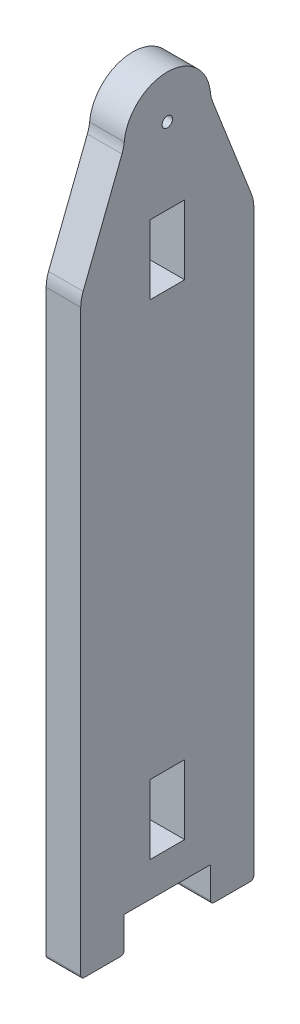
SolidWorks part; units mm, degrees
ref_plane "Front Plane" through (0, 0, 0) normal (0, 0, 1) x (1, 0, 0)
ref_plane "Top Plane" through (0, 0, 0) normal (0, 1, 0) x (1, 0, 0)
ref_plane "Right Plane" through (0, 0, 0) normal (1, 0, 0) x (0, 0, -1)
sketch "Sketch2" plane through (0, 0, 0) normal (1, 0, 0) x (0, 0, -1)
  line L0 (0, 0) -> (0, 40) construction
  line L1 (0, 40) -> (0, 320) construction
  line L2 (0, 320) -> (0, 384) construction
  line L3 (0, 0) -> (25, 0)
  line L4 (25, 0) -> (25, -20)
  line L5 (25, -20) -> (50, -20)
  line L6 (50, -20) -> (50, 320)
  line L7 (50, 320) -> (25, 384)
  line L8 (0, 0) -> (-25, 0)
  line L9 (-25, 0) -> (-25, -20)
  line L10 (-25, -20) -> (-50, -20)
  line L11 (-50, -20) -> (-50, 320)
  line L12 (-50, 320) -> (-25, 384)
  line L13 (-10, 60) -> (10, 60)
  line L14 (-10, 340) -> (10, 340)
  line L15 (-10, 340) -> (-10, 300)
  line L16 (-10, 300) -> (10, 300)
  line L17 (10, 340) -> (10, 300)
  line L18 (-10, 340) -> (10, 300) construction
  line L19 (-10, 300) -> (10, 340) construction
  line L20 (-10, 60) -> (-10, 20)
  line L21 (-10, 20) -> (10, 20)
  line L22 (10, 60) -> (10, 20)
  line L23 (-10, 60) -> (10, 20) construction
  line L24 (-10, 20) -> (10, 60) construction
  circle A0 centre (0, 384) radius 3
  arc A1 (25, 384) -> (-25, 384) centre (0, 384) ccw
  point P10 (0, 320)
  point P21 (0, 40)
  dimension "D1" = 25
  dimension "D11" = 6
  dimension "D12" = 25
  dimension "D2" = 25
  dimension "D3" = 20
  dimension "D4" = 40
  dimension "D5" = 20
  dimension "D6" = 40
  dimension "D7" = 340
  dimension "D8" = 280
  dimension "D9" = 40
  dimension "D10" = 20
  dimension "D13" = 68.7095
extrude "Boss-Extrude2" add sketch "Sketch2" along normal blind 20
fillet "Fillet1" radius 20 4 edges at (10, 320, -50) (10, 384, -25) (10, 384, 25) (10, 320, 50)
fillet "Fillet2" radius 2 4 edges at (10, -20, -50) (10, -20, -25) (10, -20, 50) (10, -20, 25)
